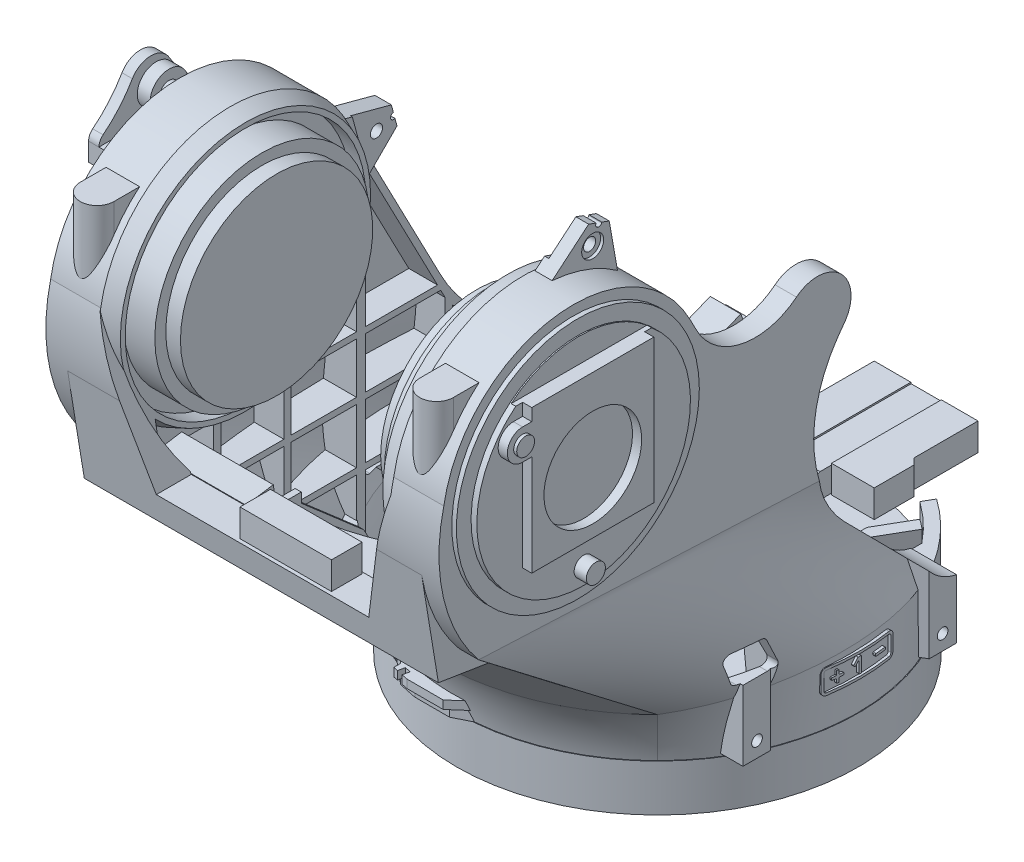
SolidWorks part; units mm, degrees
ref_plane "Piano1 (Front/Back)" through (0, 0, 0) normal (0, 0, 1) x (1, 0, 0)
ref_plane "Piano2 (Top/Bottom)" through (0, 0, 0) normal (0, 1, 0) x (1, 0, 0)
ref_plane "Piano3 (Left/Right)" through (0, 0, 0) normal (1, 0, 0) x (0, 0, -1)
imported_body "Importato1"
hole_wizard "M20 Foro filettato profondo1" positions "Schizzo2" profile "Schizzo1" tap size "M20" standard "DIN"
sketch "Schizzo2" plane through (315, 0, 0) normal (1, 0, 0) x (0, 0, -1)
  circle A0 centre (-460, 591) radius 175 construction
  arc A1 (-571.3553, 726) -> (-348.6447, 726) centre (-460, 591) ccw construction
  point P0 (-152, 30)
  point P1 (152, 30)
  dimension "D1" = 561
  dimension "D2" = 308
  dimension "D3" = 612
sketch "Schizzo1" plane through (315, 30, 152) normal (0, 1, 0) x (0, 0, -1)
  line L0 (0, 0) -> (0, 52.7575)
  line L1 (0, 52.7575) -> (8.75, 47.5)
  line L2 (8.75, 47.5) -> (8.75, 0)
  line L5 (8.75, 0) -> (0, 0)
  line L10 (0, 52.7575) -> (-8.75, 47.5) construction
  line L11 (0, -6.35) -> (0, 107.95) construction
  dimension "Tap Drill Dia." = 17.5
  dimension "Tap Drill Depth" = 47.5
  dimension "Drill Angle" = 118
hole_wizard "M20 Foro filettato profondo2" positions "Schizzo4" profile "Schizzo3" tap size "M20" standard "DIN"
sketch "Schizzo4" plane through (-315, 0, 0) normal (-1, 0, 0) x (0, 0, 1)
  arc A0 (451.2963, 765.7834) -> (468.7037, 765.7834) centre (460, 591) ccw construction
  arc A1 (348.6447, 726) -> (571.3553, 726) centre (460, 591) ccw construction
  point P0 (-152, 30)
  point P1 (152, 30)
  dimension "D1" = 561
  dimension "D2" = 308
  dimension "D3" = 612
sketch "Schizzo3" plane through (-315, 30, -152) normal (0, 1, 0) x (0, 0, 1)
  line L0 (0, 0) -> (0, 52.7575)
  line L1 (0, 52.7575) -> (8.75, 47.5)
  line L2 (8.75, 47.5) -> (8.75, 0)
  line L5 (8.75, 0) -> (0, 0)
  line L10 (0, 52.7575) -> (-8.75, 47.5) construction
  line L11 (0, -6.35) -> (0, 107.95) construction
  dimension "Tap Drill Dia." = 17.5
  dimension "Tap Drill Depth" = 47.5
  dimension "Drill Angle" = 118
